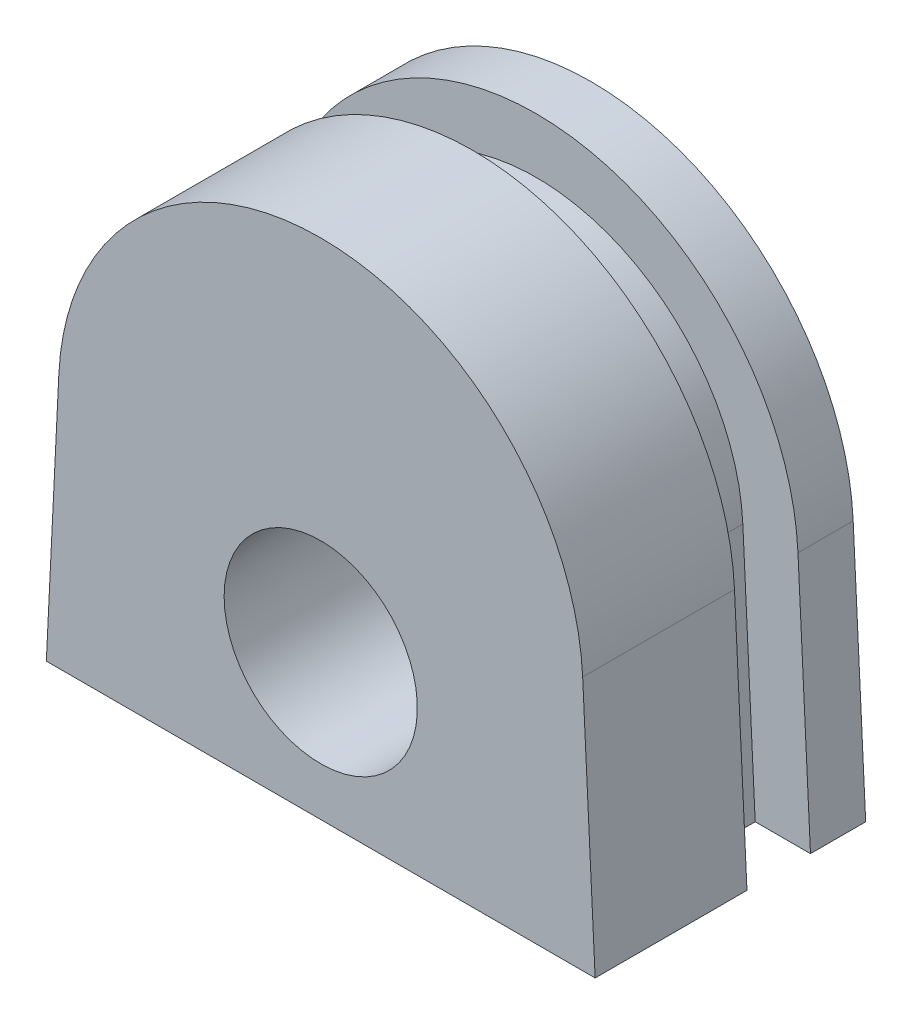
SolidWorks part; units mm, degrees
ref_plane "Plan1" through (0, 0, 0) normal (0, 0, 1) x (1, 0, 0)
ref_plane "Plan2" through (0, 0, 0) normal (0, 1, 0) x (1, 0, 0)
ref_plane "Plan3" through (0, 0, 0) normal (1, 0, 0) x (0, 0, -1)
sketch "Esquisse1" plane through (0, 0, 0) normal (0, 0, 1) x (1, 0, 0)
  line L0 (-21.741, 5.9409) -> (-22.1932, -3.271) construction
  line L1 (-6.3068, -3.271) -> (-6.759, 5.9409) construction
  line L2 (-21.741, 5.9409) -> (-22.1886, -3.1769)
  line L3 (-6.3114, -3.1769) -> (-6.759, 5.9409)
  line L6 (-6.3114, -3.1769) -> (-22.1886, -3.1769)
  arc A0 (-6.759, 5.9409) -> (-21.741, 5.9409) centre (-14.25, 5.5731) ccw construction
  arc A1 (-6.759, 5.9409) -> (-21.741, 5.9409) centre (-14.25, 5.5731) ccw
  dimension "D1" = 8.75
extrude "Base-Extrusion" add sketch "Esquisse1" against normal blind 2.3
sketch "Esquisse2" plane through (0, 0, 0) normal (0, 0, 1) x (1, 0, 0)
  line L0 (-4.309, -3.1769) -> (-24.191, -3.1769)
  line L2 (-22.1886, -3.1769) -> (-6.3114, -3.1769) construction
  line L4 (-23.7386, 6.039) -> (-24.1862, -3.0788)
  line L5 (-4.3138, -3.0788) -> (-4.7614, 6.039)
  line L6 (-23.7386, 6.039) -> (-24.191, -3.1769)
  line L7 (-4.309, -3.1769) -> (-4.7614, 6.039)
  arc A2 (-4.7614, 6.039) -> (-23.7386, 6.039) centre (-14.25, 5.5731) ccw
  arc A3 (-4.7614, 6.039) -> (-23.7386, 6.039) centre (-14.25, 5.5731) ccw
  dimension "D1" = 2
extrude "Boss.-Extru.1" add sketch "Esquisse2" along normal blind 5.5
sketch "Esquisse3" plane through (0, 0, -2.3) normal (0, 0, -1) x (-1, 0, 0)
  line L0 (4.309, -3.1769) -> (24.191, -3.1769)
  line L1 (24.191, -3.1769) -> (4.309, -3.1769) construction
  line L5 (4.2108, -5.1769) -> (24.2892, -5.1769)
  line L6 (4.7614, 6.039) -> (4.2108, -5.1769)
  line L8 (24.2892, -5.1769) -> (23.7386, 6.039)
  line L9 (4.7614, 6.039) -> (4.309, -3.1769)
  line L11 (24.191, -3.1769) -> (23.7386, 6.039)
  arc A2 (23.7386, 6.039) -> (4.7614, 6.039) centre (14.25, 5.5731) ccw
  arc A3 (23.7386, 6.039) -> (4.7614, 6.039) centre (14.25, 5.5731) ccw
  dimension "D1" = 2
extrude "Boss.-Extru.2" add sketch "Esquisse3" along normal blind 2
sketch "Esquisse4" plane through (0, 0, -4.3) normal (0, 0, -1) x (-1, 0, 0)
  line L0 (14.25, 5.5731) -> (14.25, 2.0731) construction
  circle A0 centre (14.25, 2.0731) radius 3.5
  dimension "D2" = 7
  dimension "D1" = 3.5
extrude "Enlèv. mat.-Extru.1" cut sketch "Esquisse4" against normal through all
